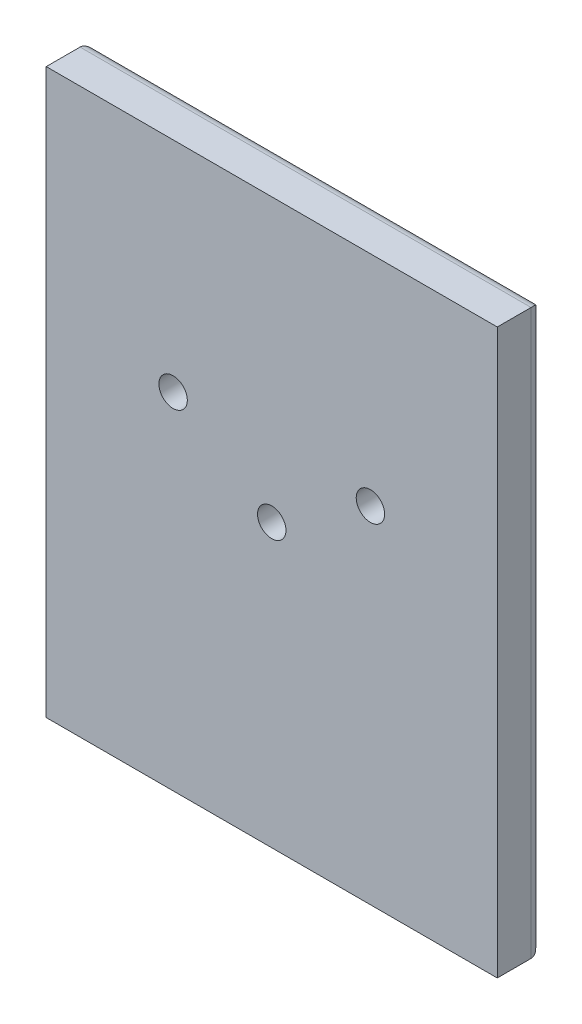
SolidWorks part; units mm, degrees
ref_plane "Front Plane" through (0, 0, 0) normal (0, 0, 1) x (1, 0, 0)
ref_plane "Top Plane" through (0, 0, 0) normal (0, 1, 0) x (1, 0, 0)
ref_plane "Right Plane" through (0, 0, 0) normal (1, 0, 0) x (0, 0, -1)
sketch "Sketch1" plane through (0, 0, 0) normal (0, 0, 1) x (1, 0, 0)
  line L1 (58.42, 6.35) -> (-43.18, 6.35)
  line L3 (58.42, -120.65) -> (-43.18, -120.65)
  line L4 (-43.18, 6.35) -> (-43.18, -120.65)
  line L5 (58.42, 6.35) -> (58.42, -120.65)
extrude "Extrude1" add sketch "Sketch1" along normal blind 10.16
fillet "Fillet1" radius 2.54 4 edges at (58.42, -57.15, 0) (7.62, -120.65, 0) (-43.18, -57.15, 0) (7.62, 6.35, 0)
sketch "Sketch3" plane through (0, 0, 0) normal (0, 0, -1) x (-1, 0, 0)
  circle A0 centre (-7.62, -57.15) radius 3.2004
  circle A1 centre (-29.845, -42.8625) radius 3.2004
  circle A2 centre (14.605, -42.8625) radius 3.2004
extrude "Cut-Extrude1" cut sketch "Sketch3" against normal through all
